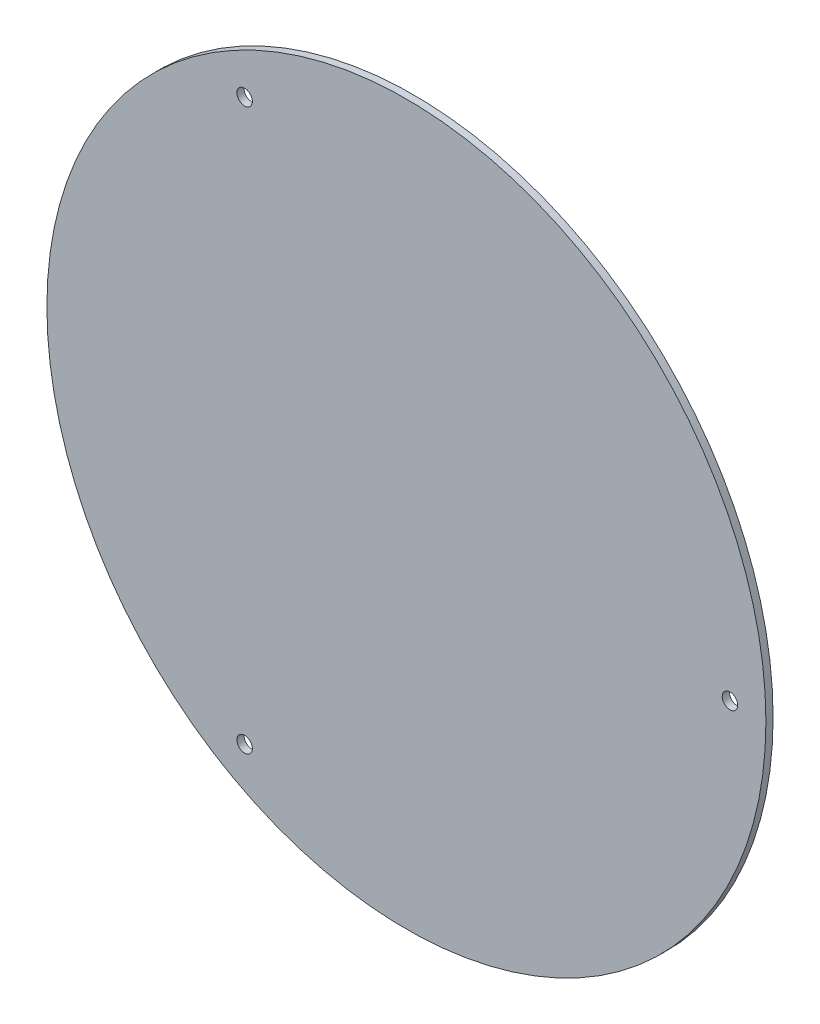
SolidWorks part; units mm, degrees
ref_plane "Plan de face" through (0, 0, 0) normal (0, 0, 1) x (1, 0, 0)
ref_plane "Plan de dessus" through (0, 0, 0) normal (0, 1, 0) x (1, 0, 0)
ref_plane "Plan de droite" through (0, 0, 0) normal (1, 0, 0) x (0, 0, -1)
sketch "Esquisse3" plane through (0, 0, 0) normal (0, 0, 1) x (1, 0, 0)
  circle A0 centre (0, 0) radius 100
  circle A1 centre (90, 0) radius 2.15
  circle A2 centre (-45, -77.9423) radius 2.15
  circle A3 centre (-45, 77.9423) radius 2.15
  dimension "D1" = 200
  dimension "D3" = 4.3
  dimension "D2" = 90
  dimension "D5" = 90
  dimension "D6" = 90
  dimension "D4" = 3
extrude "Boss.-Extru.3" add sketch "Esquisse3" along normal mid plane 2
